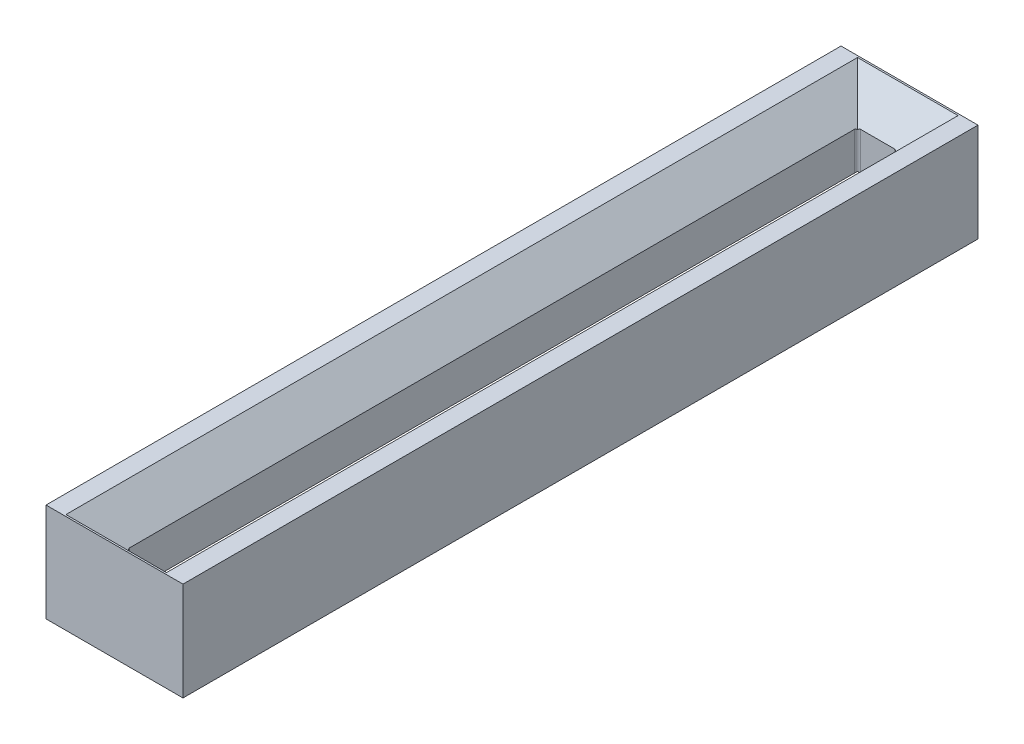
SolidWorks part; units mm, degrees
ref_plane "Front Plane" through (0, 0, 0) normal (1, 0, 0) x (0, 1, 0)
ref_plane "Top Plane" through (0, 0, 0) normal (0, 0, 1) x (0, 1, 0)
ref_plane "Right Plane" through (0, 0, 0) normal (0, 1, 0) x (-1, 0, 0)
sketch "beam" plane through (0, 0, 0) normal (0, 1, 0) x (-1, 0, 0)
  line L1 (-76.2, 1500) -> (76.2, 1500)
  line L2 (-76.2, 1500) -> (-76.2, -1500)
  line L3 (-76.2, -1500) -> (76.2, -1500)
  line L4 (76.2, 1500) -> (76.2, -1500)
  line L5 (-76.2, 1500) -> (76.2, -1500) construction
  line L6 (-76.2, -1500) -> (76.2, 1500) construction
  point P0 (0, 0)
  dimension "D1" = 3000
  dimension "D2" = 152.4
sketch "Sketch3" plane through (0, 0, 0) normal (0, 1, 0) x (-1, 0, 0)
  line L1 (-215.9, 1639.7) -> (215.9, 1639.7) construction
  line L2 (-215.9, 1639.7) -> (-215.9, -1639.7) construction
  line L3 (-215.9, -1639.7) -> (215.9, -1639.7) construction
  line L4 (215.9, 1639.7) -> (215.9, -1639.7) construction
  line L5 (-215.9, 1639.7) -> (215.9, -1639.7) construction
  line L6 (-215.9, -1639.7) -> (215.9, 1639.7) construction
  line L8 (-76.2, 1500) -> (76.2, 1500) construction
  line L9 (-76.2, 1500) -> (-76.2, -1500) construction
  circle A0 centre (-246.0625, 1669.8625) radius 30.1625
  circle A2 centre (246.0625, 1669.8625) radius 30.1625
  circle A3 centre (-246.0625, 1399.8625) radius 30.1625
  circle A4 centre (246.0625, 1399.8625) radius 30.1625
  circle A5 centre (-246.0625, 1129.8625) radius 30.1625
  circle A6 centre (246.0625, 1129.8625) radius 30.1625
  circle A7 centre (-246.0625, 859.8625) radius 30.1625
  circle A8 centre (246.0625, 859.8625) radius 30.1625
  circle A9 centre (-246.0625, 589.8625) radius 30.1625
  circle A10 centre (246.0625, 589.8625) radius 30.1625
  circle A11 centre (-246.0625, -1669.8625) radius 30.1625
  circle A12 centre (246.0625, -1669.8625) radius 30.1625
  circle A13 centre (-246.0625, -1399.8625) radius 30.1625
  circle A14 centre (246.0625, -1399.8625) radius 30.1625
  circle A15 centre (-246.0625, -1129.8625) radius 30.1625
  circle A16 centre (246.0625, -1129.8625) radius 30.1625
  circle A17 centre (-246.0625, -859.8625) radius 30.1625
  circle A18 centre (246.0625, -859.8625) radius 30.1625
  circle A19 centre (-246.0625, -589.8625) radius 30.1625
  circle A20 centre (246.0625, -589.8625) radius 30.1625
  circle A21 centre (-246.0625, -319.8625) radius 30.1625
  circle A22 centre (246.0625, -319.8625) radius 30.1625
  circle A25 centre (-246.0625, 319.8625) radius 30.1625
  circle A26 centre (246.0625, 319.8625) radius 30.1625
  point P2 (0, 0)
  dimension "D1" = 60.325
  dimension "D4" = 6
  dimension "D5" = 60.325
  dimension "D6" = 60.325
  dimension "D7" = 60.325
  dimension "D2" = 139.7
  dimension "D3" = 139.7
  dimension "D8" = 6
sketch "Sketch2" plane through (0, 0, 0) normal (0, 1, 0) x (-1, 0, 0)
  line L5 (-282.225, 1706.025) -> (282.225, 1706.025)
  line L6 (-282.225, 1706.025) -> (-282.225, -1706.025)
  line L7 (-282.225, -1706.025) -> (282.225, -1706.025)
  line L8 (82.2, 1506) -> (-82.2, 1506)
  line L9 (-82.2, 1506) -> (-82.2, -1506)
  line L10 (-82.2, -1506) -> (82.2, -1506)
  line L11 (82.2, -1506) -> (82.2, 1506)
  line L12 (82.2, 1506) -> (-82.2, 1506)
  line L13 (-82.2, 1506) -> (-82.2, -1506)
  line L14 (-82.2, -1506) -> (82.2, -1506)
  line L15 (82.2, -1506) -> (82.2, 1506)
  line L16 (282.225, 1706.025) -> (282.225, -1706.025)
  line L17 (-276.225, 1700.025) -> (276.225, 1700.025) construction
  line L18 (-276.225, 1700.025) -> (-276.225, -1700.025) construction
  line L19 (-276.225, -1700.025) -> (276.225, -1700.025) construction
  line L20 (276.225, 1700.025) -> (276.225, -1700.025) construction
  circle A0 centre (-246.0625, 1669.8625) radius 30.1625 construction
  circle A1 centre (-246.0625, 1399.8625) radius 30.1625 construction
  circle A2 centre (246.0625, 1669.8625) radius 30.1625 construction
  circle A3 centre (-246.0625, -1669.8625) radius 30.1625 construction
  dimension "D2" = 6
  dimension "D3" = 6
  dimension "D4" = 6
  dimension "D5" = 6
  dimension "D1" = 6
extrude "Boss-Extrude2" add sketch "Sketch2" along normal mid plane 406.4
chamfer "Chamfer1" distance 125 angle 45 8 edges at (82.2, 203.2, 0) (0, 203.2, -1506) (-82.2, 203.2, 0) (0, 203.2, 1506) (0, -203.2, -1506) (82.2, -203.2, 0) (-82.2, -203.2, 0) (0, -203.2, 1506)
fillet "Fillet1" radius 13 4 edges at (82.2, 0, 1506) (-82.2, 0, 1506) (-82.2, 0, -1506) (82.2, 0, -1506)
sketch "Sketch5" plane through (0, 0, 0) normal (0, 1, 0) x (-1, 0, 0)
  line L0 (-207.2, 1631) -> (207.2, 1631) construction
  line L1 (-432.7693, 1835.0297) -> (464.8102, 1835.0297)
  line L2 (-432.7693, 1835.0297) -> (-432.7693, 1638)
  line L3 (-432.7693, 1638) -> (464.8102, 1638)
  line L4 (464.8102, 1835.0297) -> (464.8102, 1638)
  line L5 (207.2, -1631) -> (-207.2, -1631) construction
  line L6 (-432.7693, -1638) -> (464.8102, -1638)
  line L7 (-432.7693, -1638) -> (-432.7693, -1842.5399)
  line L8 (-432.7693, -1842.5399) -> (464.8102, -1842.5399)
  line L9 (464.8102, -1638) -> (464.8102, -1842.5399)
  dimension "D1" = 7
  dimension "D2" = 7
extrude "Cut-Extrude1" cut sketch "Sketch5" against normal through all both and the other way through all
